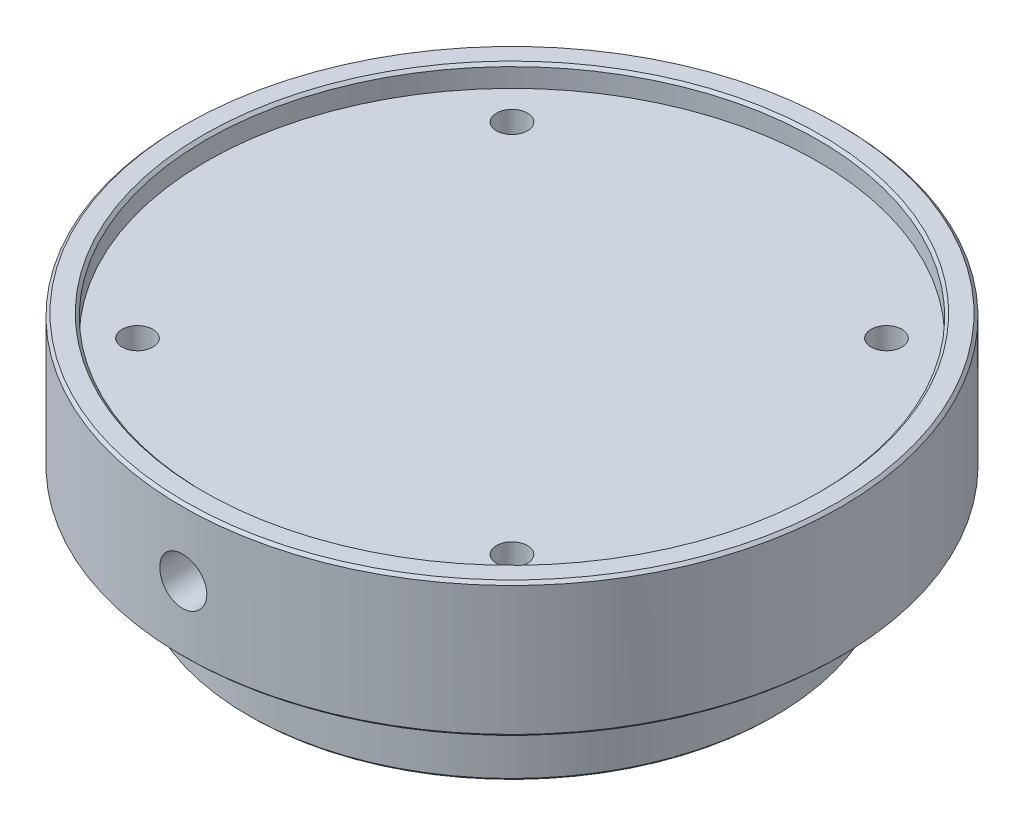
SolidWorks part; units mm, degrees
ref_plane "Front Plane" through (0, 0, 0) normal (0, 0, 1) x (1, 0, 0)
ref_plane "Top Plane" through (0, 0, 0) normal (0, 1, 0) x (1, 0, 0)
ref_plane "Right Plane" through (0, 0, 0) normal (1, 0, 0) x (0, 0, -1)
sketch "Sketch1" plane through (0, 0, 0) normal (0, 0, 1) x (1, 0, 0)
  line L0 (0, 0) -> (0, -29.591) construction
  line L1 (0, -29.591) -> (0, -2.921)
  line L6 (0, -2.921) -> (41.275, -2.921)
  line L7 (41.275, -2.921) -> (41.275, 0)
  line L8 (41.275, 0) -> (44.45, 0)
  line L9 (44.45, 0) -> (44.45, -18.161)
  line L10 (44.45, -18.161) -> (35.56, -18.161)
  line L17 (35.56, -18.161) -> (35.56, -29.591)
  line L18 (35.56, -29.591) -> (0, -29.591)
  dimension "D2" = 29.591
  dimension "D4" = 71.12
  dimension "D9" = 2.921
  dimension "D10" = 82.55
  dimension "D16" = 18.161
  dimension "D17" = 88.9
revolve "Revolve1" add sketch "Sketch1" angle 360 about L0
chamfer "Chamfer1" distance 0.381 angle 45 4 edges at (-41.275, 0, 0) (-44.45, 0, 0) (-35.56, -29.591, 0) (-44.45, -18.161, 0)
sketch "Sketch2" plane through (0, -2.921, 0) normal (0, 1, 0) x (1, 0, 0)
  line L0 (-25.257, -25.257) -> (25.257, 25.257) construction
  line L1 (-25.257, 25.257) -> (25.257, -25.257) construction
  line L2 (0, 0) -> (17.2649, 0) construction
  circle A0 centre (0, 0) radius 35.7188 construction
  circle A1 centre (0, 0) radius 41.275 construction
  dimension "D1" = 71.4375
  dimension "D2" = 45
hole_wizard "#8-32 Tapped Hole1" positions "3DSketch2" profile "Sketch4" tap size "#8-32" standard "Ansi Inch"
sketch3d "3DSketch2"
  point P0 (-25.257, -2.921, -25.257)
  point P3 (-25.257, -2.921, 25.257)
  point P6 (25.257, -2.921, -25.257)
  point P9 (25.257, -2.921, 25.257)
sketch "Sketch4" plane through (-25.257, -2.921, -25.257) normal (1, 0, 0) x (0, 0, 1)
  line L0 (0, 0) -> (0, 12.4678)
  line L1 (0, 12.4678) -> (1.7272, 11.43)
  line L2 (1.7272, 11.43) -> (1.7272, 9.652)
  line L3 (1.7272, 9.652) -> (2.0828, 9.652)
  line L4 (2.0828, 9.652) -> (2.0828, 0)
  line L5 (2.0828, 0) -> (0, 0)
  line L10 (0, 12.4678) -> (-1.7272, 11.43) construction
  line L11 (0, -6.35) -> (0, 107.95) construction
  dimension "Tap Drill Dia." = 3.4544
  dimension "Tap Drill Depth" = 11.43
  dimension "Thread Major Dia." = 4.1656
  dimension "Thread Depth" = 9.652
  dimension "Drill Angle" = 118
ref_axis "Axis1" through (0, -17.78, 0) along (0, 1, 0)
ref_plane "Plane3" through (0, 0, 44.45) normal (0, 0, 1) x (1, 0, 0)
sketch "Sketch8" plane through (0, 0, 44.45) normal (0, 0, -1) x (-1, 0, 0)
  line L0 (0, 0) -> (0, -18.161) construction
  line L2 (-35.56, -18.161) -> (35.56, -18.161) construction
hole_wizard "1/4-20 Tapped Hole1" positions "3DSketch4" profile "Sketch9" tap size "1/4-20" standard "Ansi Inch"
sketch3d "3DSketch4"
  line L0 (0, 0, 44.45) -> (0, -18.161, 44.45) construction
  point P0 (0, -9.0805, 44.45)
sketch "Sketch9" plane through (0, -9.0805, 44.45) normal (1, 0, 0) x (0, -1, 0)
  line L0 (0, 0) -> (0, 18.0438)
  line L1 (0, 18.0438) -> (2.5527, 16.51)
  line L2 (2.5527, 16.51) -> (2.5527, 12.7)
  line L3 (2.5527, 12.7) -> (3.175, 12.7)
  line L4 (3.175, 12.7) -> (3.175, 0)
  line L5 (3.175, 0) -> (0, 0)
  line L10 (0, 18.0438) -> (-2.5527, 16.51) construction
  line L11 (0, -6.35) -> (0, 107.95) construction
  dimension "Tap Drill Dia." = 5.1054
  dimension "Tap Drill Depth" = 16.51
  dimension "Thread Major Dia." = 6.35
  dimension "Thread Depth" = 12.7
  dimension "Drill Angle" = 118
pattern_circular "CirPattern1" count 2 over 360 about axis through (0, -17.78, 0) along (0, 1, 0) of "1/4-20 Tapped Hole1"
